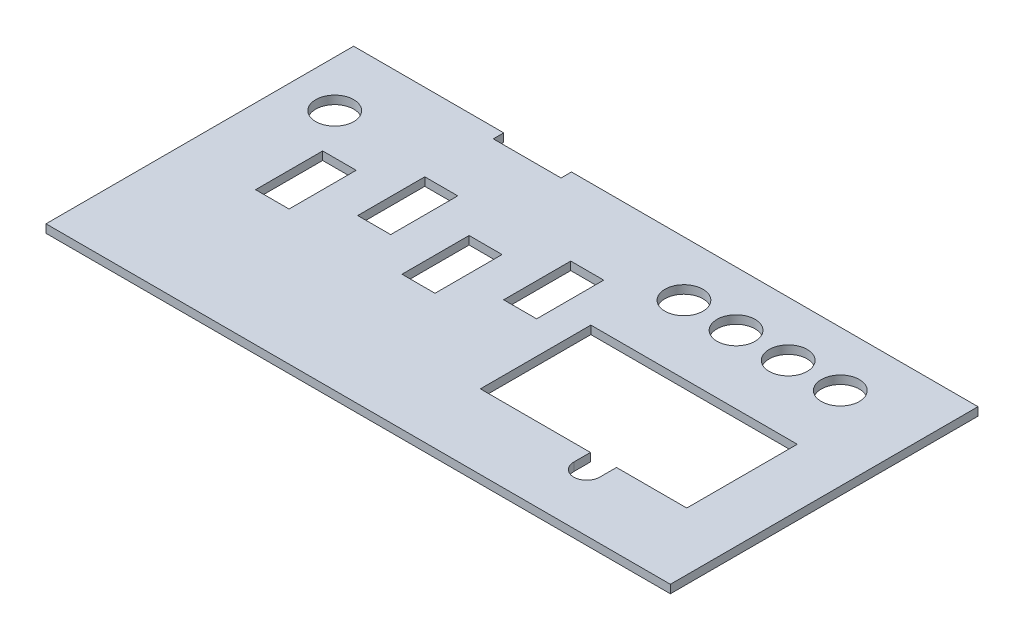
SolidWorks part; units mm, degrees
ref_plane "X_Y" through (0, 0, 0) normal (0, 0, 1) x (1, 0, 0)
ref_plane "Z_X" through (0, 0, 0) normal (0, 1, 0) x (1, 0, 0)
ref_plane "Y_Z" through (0, 0, 0) normal (1, 0, 0) x (0, 0, -1)
sketch "Sketch1" plane through (0, 0, 0) normal (0, 1, 0) x (1, 0, 0)
  line L1 (-75, -35) -> (75, -35)
  line L2 (-75, -35) -> (-75, 35)
  line L3 (-75, 35) -> (75, 35)
  line L4 (75, -35) -> (75, 35)
  line L5 (-75, -35) -> (75, 35) construction
  line L6 (-75, 35) -> (75, -35) construction
  point P0 (0, 0)
  dimension "D1" = 70
  dimension "D2" = 150
extrude "Boss-Extrude1" add sketch "Sketch1" along normal blind 1.5875
sketch "Sketch3" plane through (0, 0, 0) normal (0, -1, 0) x (1, 0, 0)
  line L9 (59.895, -30.02) -> (59.895, 29)
  line L10 (59.895, 29) -> (-59.895, 29)
  line L11 (-59.895, 29) -> (-59.895, -30.02)
  line L12 (59.895, -30.02) -> (59.895, 29)
  line L13 (59.895, 29) -> (-59.895, 29)
  line L14 (-59.895, 29) -> (-59.895, -30.02)
  line L162 (-31.1, -30.02) -> (-31.1, -28.02)
  line L163 (-69.0817, -30.02) -> (-31.1, -30.02)
  line L164 (-69.0817, 27.1759) -> (-69.0817, -30.02)
  line L165 (62.2359, 34.0217) -> (-62.2359, 34.0217)
  line L170 (69.0817, -30.02) -> (69.0817, 27.1759)
  line L171 (-18.1, -30.02) -> (69.0817, -30.02)
  line L172 (-18.1, -28.02) -> (-18.1, -30.02)
  line L173 (-31.1, -28.02) -> (-18.1, -28.02)
  line L174 (-31.1, -30.02) -> (-31.1, -28.02)
  line L175 (-59.895, -30.02) -> (-31.1, -30.02)
  line L183 (-18.1, -30.02) -> (59.895, -30.02)
  line L184 (-18.1, -28.02) -> (-18.1, -30.02)
  line L185 (-31.1, -28.02) -> (-18.1, -28.02)
  ellipse E2 centre (-62.2276, 27.1676) end of major axis (-67.0772, 32.0172) minor radius 6.85 (-62.2359, 34.0217) -> (-69.0817, 27.1759) ccw
  ellipse E3 centre (62.2276, 27.1676) end of major axis (57.378, 22.318) minor radius 6.85 (69.0817, 27.1759) -> (62.2359, 34.0217) ccw
  dimension "D1" = 0
  dimension "D2" = 1
extrude "Cut-Extrude1" cut sketch "Sketch3" against normal blind 10 flip side to cut
sketch "Sketch6" plane through (0, 1.5875, 0) normal (0, 1, 0) x (1, 0, 0)
  line L12 (48.8, -14.76) -> (9.2, -14.76)
  line L13 (8.5, -15.46) -> (29.32, -15.46) construction
  line L14 (-17.3655, 9.6431) -> (-17.3655, -3.2302)
  line L15 (-11.0345, 9.6431) -> (-17.3655, 9.6431)
  line L16 (-17.3655, -3.2302) -> (-11.0345, -3.2302)
  line L17 (-11.0345, -3.2302) -> (-11.0345, 9.6431)
  line L18 (-17.3655, 9.6431) -> (-17.3655, -3.2302)
  line L19 (-11.0345, 9.6431) -> (-17.3655, 9.6431)
  line L20 (-17.3655, -3.2302) -> (-11.0345, -3.2302)
  line L21 (-11.0345, -3.2302) -> (-11.0345, 9.6431)
  line L23 (9.2, 6.44) -> (9.2, -15.46)
  line L24 (48.8, 6.44) -> (9.2, 6.44)
  line L25 (48.8, -15.46) -> (48.8, 6.44)
  line L26 (9.2, 6.44) -> (9.2, -14.76)
  line L27 (48.8, 6.44) -> (9.2, 6.44)
  line L28 (48.8, -14.76) -> (48.8, 6.44)
  line L32 (-31.3655, 2.2698) -> (-25.0345, 2.2698)
  line L33 (-31.3655, 15.1431) -> (-31.3655, 2.2698)
  line L34 (-25.0345, 15.1431) -> (-31.3655, 15.1431)
  line L35 (-25.0345, 2.2698) -> (-25.0345, 15.1431)
  line L60 (-31.3655, 2.2698) -> (-25.0345, 2.2698)
  line L61 (-31.3655, 15.1431) -> (-31.3655, 2.2698)
  line L62 (-25.0345, 15.1431) -> (-31.3655, 15.1431)
  line L63 (-25.0345, 2.2698) -> (-25.0345, 15.1431)
  line L74 (-45.46, -3.2302) -> (-39.0345, -3.2302)
  line L75 (-45.46, 9.6431) -> (-45.46, -3.2302)
  line L76 (-39.0345, 9.6431) -> (-45.46, 9.6431)
  line L77 (-39.0345, -3.2302) -> (-39.0345, 9.6431)
  line L78 (-45.46, -3.2302) -> (-39.0345, -3.2302)
  line L79 (-45.46, 9.6431) -> (-45.46, -3.2302)
  line L80 (-39.0345, 9.6431) -> (-45.46, 9.6431)
  line L81 (-39.0345, -3.2302) -> (-39.0345, 9.6431)
  line L273 (-3.3655, 15.1431) -> (-3.3655, 2.2698)
  line L274 (2.9655, 15.1431) -> (-3.3655, 15.1431)
  line L275 (-3.3655, 2.2698) -> (2.9655, 2.2698)
  line L276 (2.9655, 2.2698) -> (2.9655, 15.1431)
  line L277 (-3.3655, 15.1431) -> (-3.3655, 2.2698)
  line L278 (2.9655, 15.1431) -> (-3.3655, 15.1431)
  line L279 (-3.3655, 2.2698) -> (2.9655, 2.2698)
  line L280 (2.9655, 2.2698) -> (2.9655, 15.1431)
  circle A2 centre (14, 19.5) radius 3.65
  circle A3 centre (14, 19.5) radius 3.65
  circle A4 centre (64.495, 5.21) radius 3.6
  circle A5 centre (64.495, 5.21) radius 3.6
  circle A7 centre (-64.495, 5.21) radius 3.6
  circle A8 centre (-64.495, 5.21) radius 3.6
  circle A32 centre (-51, 17.5) radius 3.65
  circle A33 centre (-51, 17.5) radius 3.65
  circle A141 centre (24, 19.5) radius 3.65
  circle A142 centre (24, 19.5) radius 3.65
  circle A144 centre (34, 19.5) radius 3.65
  circle A145 centre (34, 19.5) radius 3.65
  circle A147 centre (44, 19.5) radius 3.65
  circle A148 centre (44, 19.5) radius 3.65
  dimension "D13" = 0.7
  dimension "D2" = 0.7
  dimension "D3" = 0.7
  dimension "D4" = 0.7
  dimension "D5" = 0.7
  dimension "D6" = 0.7
  dimension "D7" = 0.7
  dimension "D8" = 0.7
  dimension "D9" = 0.7
  dimension "D10" = 0.7
  dimension "D11" = 0
  dimension "D12" = 0
  dimension "D14" = 0.7
extrude "Cut-Extrude2" cut sketch "Sketch6" against normal through all
sketch "Sketch7" plane through (0, 0, 0) normal (0, -1, 0) x (1, 0, 0)
  line L7 (30.32, 14.76) -> (35.32, 14.76)
  line L11 (9.2, 14.76) -> (48.8, 14.76) construction
  line L16 (35.32, 17.96) -> (35.32, 15.46)
  line L17 (30.32, 15.46) -> (30.32, 17.96)
  line L18 (35.32, 17.96) -> (35.32, 14.76)
  line L19 (30.32, 14.76) -> (30.32, 17.96)
  arc A10 (35.32, 17.96) -> (30.32, 17.96) centre (32.82, 17.96) ccw
  arc A11 (35.32, 17.96) -> (30.32, 17.96) centre (32.82, 17.96) ccw
  dimension "D1" = 1
extrude "Cut-Extrude3" cut sketch "Sketch7" against normal through all
